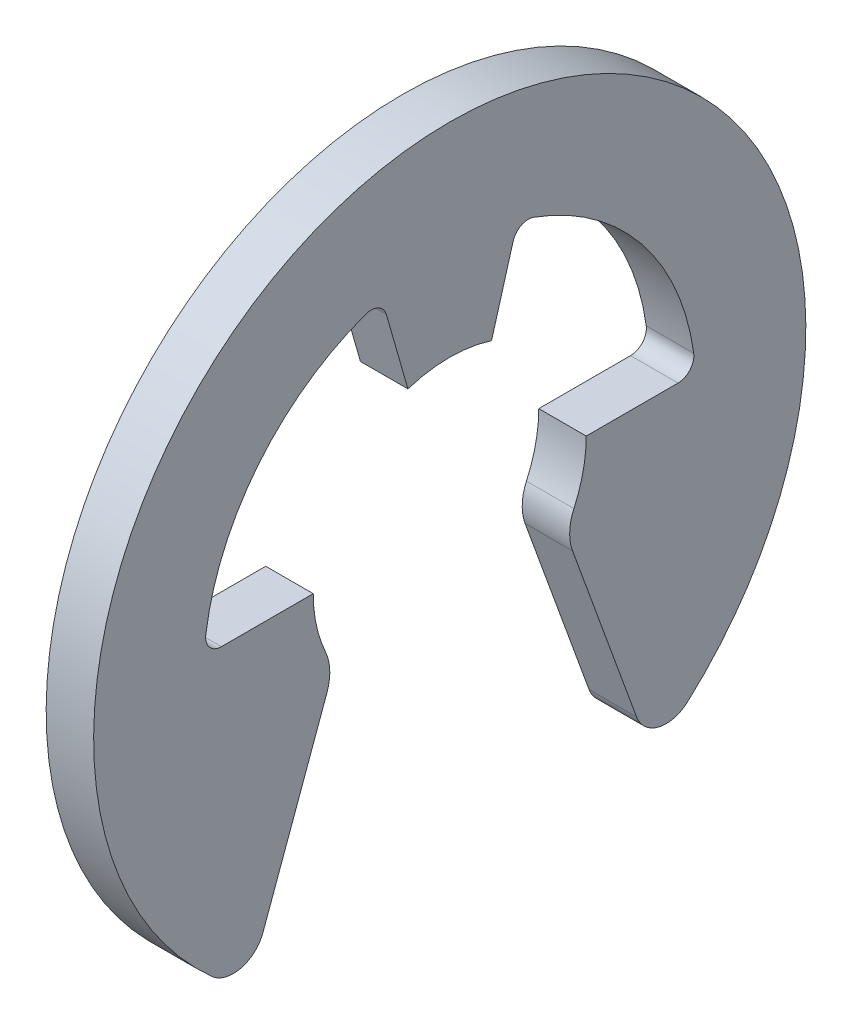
SolidWorks part; units mm, degrees
ref_plane "Plan1" through (0, 0, 0) normal (0, 0, 1) x (1, 0, 0)
ref_plane "Plan2" through (0, 0, 0) normal (0, 1, 0) x (1, 0, 0)
ref_plane "Plan3" through (0, 0, 0) normal (1, 0, 0) x (0, 0, -1)
sketch "Esquisse1" plane through (0, 0, 0) normal (1, 0, 0) x (0, 0, -1)
  line L0 (0, 0) -> (1.6991, -2.4725) construction
  line L1 (0, 0) -> (0, -9.1601) construction
  line L2 (-20, 0) -> (20, 0) construction
  line L3 (0, 0) -> (0.8269, 2.8838) construction
  line L4 (-20, 0.1333) -> (20, 0.1333) construction
  line L5 (0.3521, 1.2281) -> (1.6991, -2.4725) construction
  line L6 (0.3521, 1.2281) -> (0.5339, 1.862)
  line L7 (-1.15, 0.1333) -> (-1.9233, 0.1333)
  line L8 (1.0344, -0.6465) -> (1.5733, -2.127)
  line L9 (1.15, 0.1333) -> (1.9233, 0.1333)
  line L10 (-1.0344, -0.6465) -> (-1.5733, -2.127)
  line L11 (-0.3521, 1.2281) -> (-0.5339, 1.862)
  arc A0 (2.0018, -2.2344) -> (-2.0018, -2.2344) centre (0, 0) ccw
  arc A1 (2.0553, 0.285) -> (0.7076, 1.9506) centre (0, 0) ccw
  arc A2 (0.3521, 1.2281) -> (-0.3521, 1.2281) centre (0, 0.1333) ccw
  arc A3 (1.15, 0.1333) -> (1.0464, -0.3438) centre (0, 0.1333) cw
  arc A4 (2.0018, -2.2344) -> (1.5733, -2.127) centre (1.8239, -2.0358) cw
  arc A5 (0.7076, 1.9506) -> (0.5339, 1.862) centre (0.6621, 1.8253) ccw
  arc A6 (2.0553, 0.285) -> (1.9233, 0.1333) centre (1.9233, 0.2667) cw
  arc A7 (-2.0553, 0.285) -> (-1.9233, 0.1333) centre (-1.9233, 0.2667) ccw
  arc A8 (-0.7076, 1.9506) -> (-0.5339, 1.862) centre (-0.6621, 1.8253) cw
  arc A9 (-2.0018, -2.2344) -> (-1.5733, -2.127) centre (-1.8239, -2.0358) ccw
  arc A10 (-1.15, 0.1333) -> (-1.0464, -0.3438) centre (0, 0.1333) ccw
  arc A11 (-2.0553, 0.285) -> (-0.7076, 1.9506) centre (0, 0) cw
  arc A12 (1.0344, -0.6465) -> (1.0464, -0.3438) centre (1.4103, -0.5097) cw
  arc A13 (-1.0344, -0.6465) -> (-1.0464, -0.3438) centre (-1.4103, -0.5097) ccw
  point P24 (0.5719, 1.9946)
  dimension "D1" = 3
  dimension "D2" = 0.1333
  dimension "D3" = 2.075
  dimension "D4" = 0.2667
  dimension "D7" = 0.4
  dimension "D8" = 16
  dimension "D9" = 20
extrude "Base-Extrusion" add sketch "Esquisse1" along normal blind 0.4
equation "\"D3@Esquisse1\" = (\"D1@Esquisse1\"+\"dn@Esquisse1\")/2"
equation "\"D4@Esquisse1\"=\"r@Esquisse1\"*2"
equation "\"r@Esquisse1\"=\"D1@Base-Extrusion\"/3"
equation "\"D2@Esquisse1\"=\"D1@Base-Extrusion\"/3"
